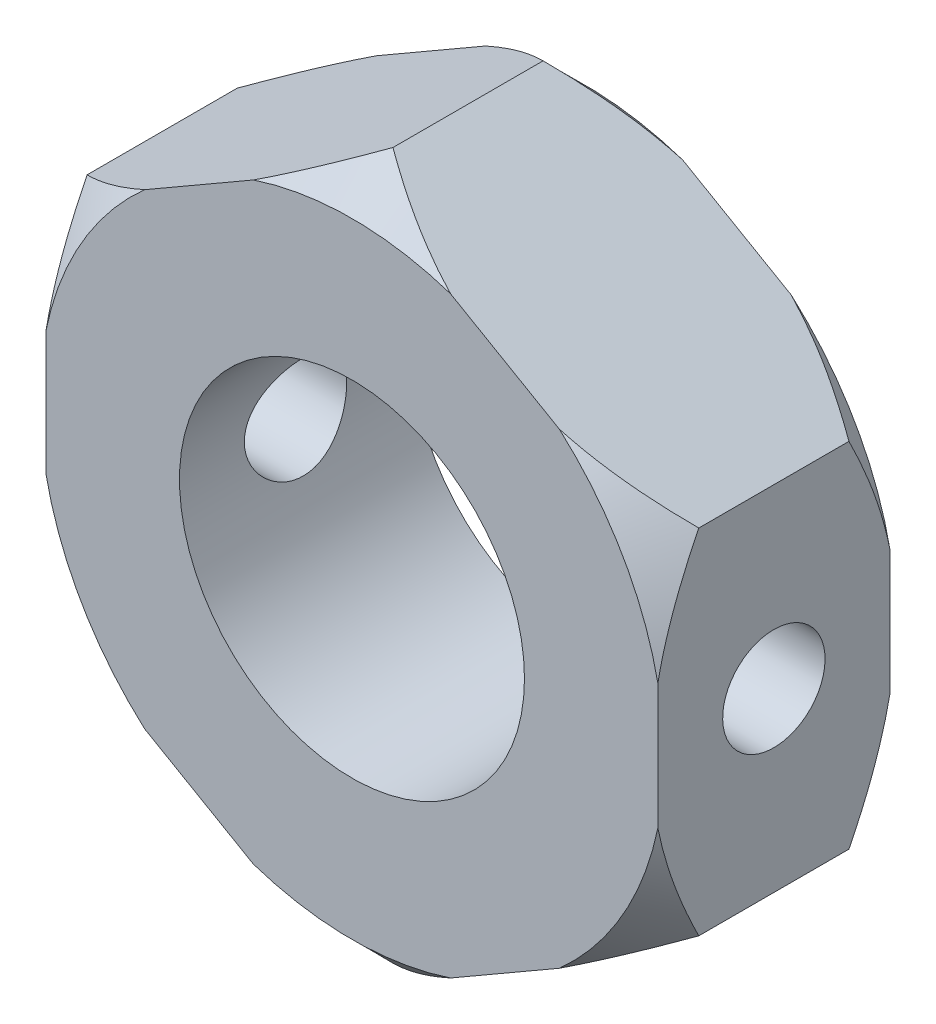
SolidWorks part; units mm, degrees
ref_plane "Plan1" through (0, 0, 0) normal (0, 0, 1) x (1, 0, 0)
ref_plane "plan2" through (0, 0, 0) normal (0, 1, 0) x (1, 0, 0)
ref_plane "Plan3" through (0, 0, 0) normal (1, 0, 0) x (0, 0, -1)
sketch "Esquisse1" plane through (0, 0, 0) normal (0, 0, 1) x (1, 0, 0)
  circle A0 centre (0, 0) radius 10.35
  circle A1 centre (0, 0) radius 5.055
  dimension "D1" = 20.7
  dimension "D2" = 10.11
extrude "Base-Extrusion" add sketch "Esquisse1" along normal blind 6.8
chamfer "Chanfrein1" distance 1.2 angle 45
sketch "Esquisse2" plane through (0, 0, 6.8) normal (0, 0, 1) x (1, 0, 0)
  line L3 (0, 10.35) -> (8.9634, 5.175)
  circle A1 centre (0, 0) radius 10.35 construction
  arc A2 (8.9634, 5.175) -> (0, 10.35) centre (0, 0) ccw
extrude "Enlèv. mat.-Extru.2" cut sketch "Esquisse2" against normal through all
pattern_circular "Répétition circulaire1" count 6 every 60
ref_plane "Plan4" through (0, 0, 8.55) normal (0, 0, 1) x (1, 0, 0)
sketch "Esquisse6" plane through (8.9634, 0, 0) normal (1, 0, 0) x (0, 0, -1)
  line L0 (-6.8, 1.8386) -> (-6.8, -1.8386) construction
  circle A0 centre (-3.4, 0) radius 1.5
  dimension "D2" = 3
  dimension "D1" = 3.4
extrude "Enlèv. mat.-Extru.3" cut sketch "Esquisse6" against normal through all
